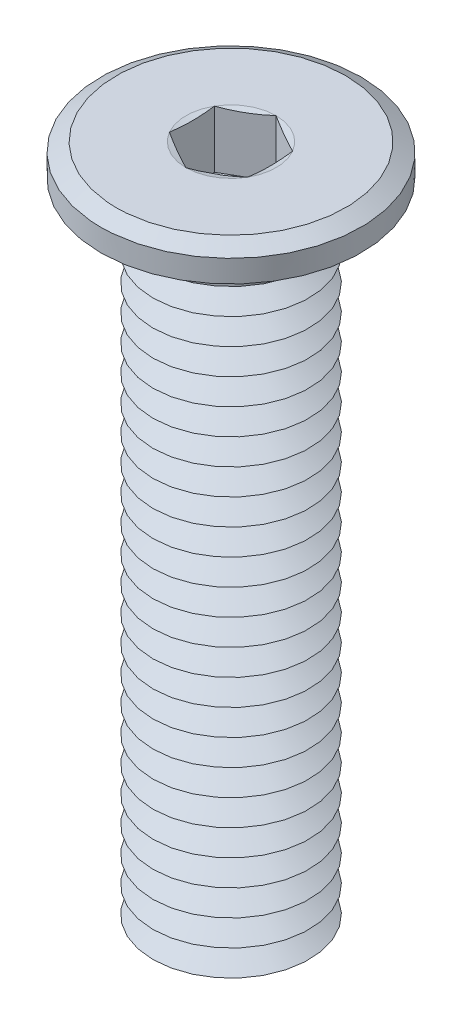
SolidWorks part; units mm, degrees
ref_plane "Front Plane" through (0, 0, 0) normal (0, 0, 1) x (1, 0, 0)
ref_plane "Top Plane" through (0, 0, 0) normal (0, 1, 0) x (1, 0, 0)
ref_plane "Right Plane" through (0, 0, 0) normal (1, 0, 0) x (0, 0, -1)
sketch "Sketch1" plane through (0, 0, 0) normal (0, 1, 0) x (1, 0, 0)
  circle A0 centre (0, 0) radius 5
  dimension "D1" = 10
extrude "Boss-Extrude1" add sketch "Sketch1" against normal blind 1.2
sketch "Sketch2" plane through (0, -1.2, 0) normal (0, -1, 0) x (1, 0, 0)
  circle A0 centre (0, 0) radius 3
  dimension "D1" = 6
extrude "Boss-Extrude2" add sketch "Sketch2" along normal blind 25
sketch "Sketch3" plane through (0, 0, 0) normal (1, 0, 0) x (0, 0, -1)
  line L0 (0, 0.9906) -> (0, -8.2999) construction
sketch "Sketch5" plane through (0, 0, 0) normal (1, 0, 0) x (0, 0, -1)
  line L0 (-3, -26.7) -> (-2.134, -26.2)
  line L1 (-3, -1.2) -> (-3, -26.2) construction
  line L2 (-2.134, -26.2) -> (-3, -25.7)
  line L3 (-3, -1.2) -> (-3, -26.2) construction
  line L4 (-3, -25.7) -> (-3, -26.7)
  line L6 (-3, -1.2) -> (-3, -26.2) construction
  line L7 (-3, -1.2) -> (-3, -26.2) construction
  line L14 (-3, -26.2) -> (3, -26.2) construction
  dimension "D1" = 1
revolve "Cut-Revolve1" cut sketch "Sketch5" angle 360 about L0
pattern_linear "LPattern1" count 24 spacing 1 along (0, 1, 0) of "Cut-Revolve1"
fillet "Fillet1" radius 0.25 1 edges at (0, -1.2, -3)
chamfer "Chamfer2" distance 0.6 angle 30 1 edges at (0, 0, 5)
sketch "Sketch6" plane through (0, 0, 0) normal (0, 1, 0) x (1, 0, 0)
  line L1 (0, 1.7321) -> (-1.5, 0.866)
  line L2 (-1.5, 0.866) -> (-1.5, -0.866)
  line L3 (-1.5, -0.866) -> (0, -1.7321)
  line L4 (0, -1.7321) -> (1.5, -0.866)
  line L5 (1.5, -0.866) -> (1.5, 0.866)
  line L6 (1.5, 0.866) -> (0, 1.7321)
  circle A0 centre (0, 0) radius 1.5 construction
  dimension "D1" = 3
extrude "Cut-Extrude1" cut sketch "Sketch6" against normal blind 2.2
sketch "Sketch7" plane through (0, -2.2, 0) normal (0, 1, 0) x (1, 0, 0)
  line L0 (-1.5, 0.866) -> (-1.5, -0.866) construction
  circle A0 centre (0, 0) radius 1.5
extrude "Cut-Extrude2" cut sketch "Sketch7" against normal through all draft 60
sketch "Sketch8" plane through (0, 0, 0) normal (0, 1, 0) x (1, 0, 0)
  circle A0 centre (0, 0) radius 1.7321
extrude "Cut-Extrude3" cut sketch "Sketch8" against normal through all draft 75
